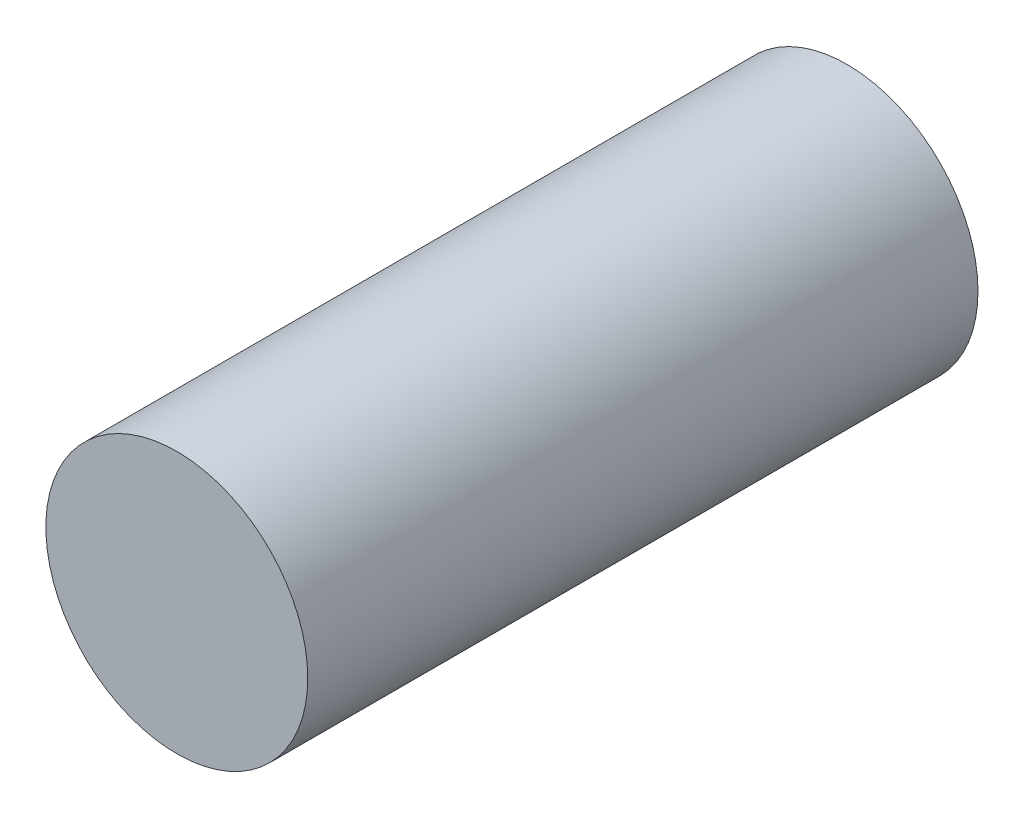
SolidWorks part; units mm, degrees
ref_plane "Plano frontal" through (0, 0, 0) normal (0, 0, 1) x (1, 0, 0)
ref_plane "Plano superior" through (0, 0, 0) normal (0, 1, 0) x (1, 0, 0)
ref_plane "Plano direito" through (0, 0, 0) normal (1, 0, 0) x (0, 0, -1)
sketch "Esboço1" plane through (0, 0, 0) normal (0, 0, 1) x (1, 0, 0)
  circle A0 centre (0, 0) radius 12.7
extrude "Ressalto-extrusão1" add sketch "Esboço1" along normal blind 65
